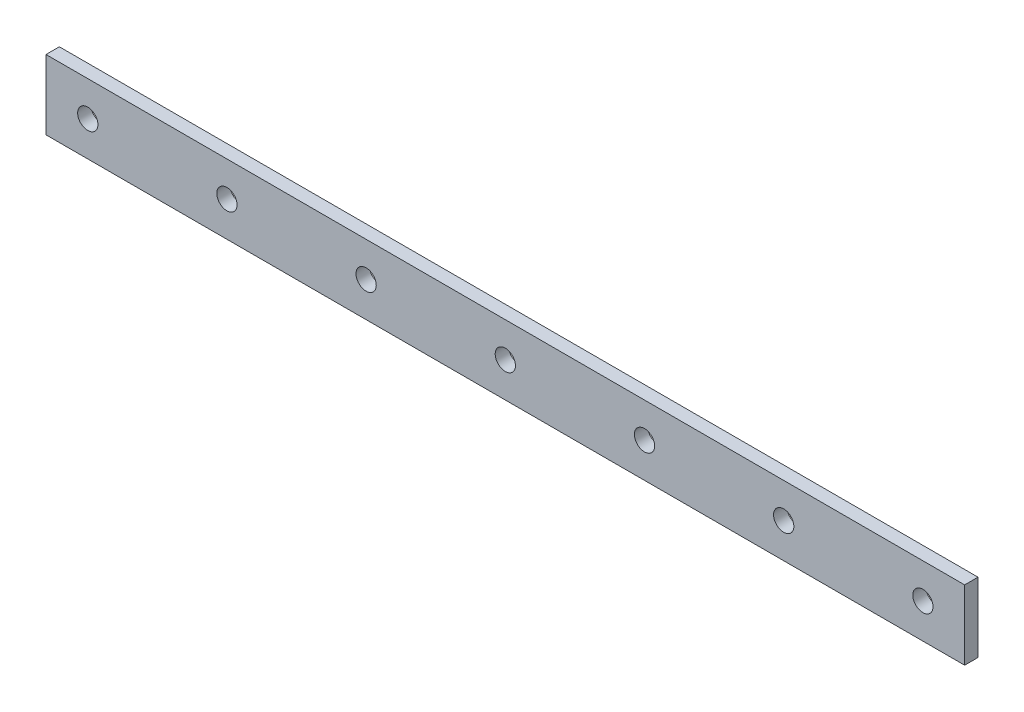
SolidWorks part; units mm, degrees
ref_plane "Front Plane" through (0, 0, 0) normal (0, 0, 1) x (1, 0, 0)
ref_plane "Top Plane" through (0, 0, 0) normal (0, 1, 0) x (1, 0, 0)
ref_plane "Right Plane" through (0, 0, 0) normal (1, 0, 0) x (0, 0, -1)
sketch "Sketch1" plane through (0, 0, 0) normal (0, 0, 1) x (1, 0, 0)
  line L0 (0, 0) -> (0, 41.5923) construction
  line L2 (52.3875, -3.9687) -> (-52.3875, -3.9688)
  line L3 (52.3875, -3.9687) -> (52.3875, 3.9688)
  line L4 (52.3875, 3.9688) -> (-52.3875, 3.9687)
  line L5 (-52.3875, -3.9688) -> (-52.3875, 3.9687)
  line L6 (52.3875, -3.9687) -> (-52.3875, 3.9687) construction
  line L7 (52.3875, 3.9688) -> (-52.3875, -3.9688) construction
  dimension "D1" = 7.9375
  dimension "D2" = 104.775
extrude "Boss-Extrude1" add sketch "Sketch1" along normal blind 1.524
sketch "Sketch2" plane through (0, 0, 1.524) normal (0, 0, 1) x (1, 0, 0)
  circle A0 centre (0, 0) radius 1.1557
  dimension "D1" = 2.3114
extrude "Cut-Extrude1" cut sketch "Sketch2" against normal through all
pattern_linear "LPattern1" count 4 spacing 15.875 along (1, 0, 0) count 4 spacing 15.875 along (-1, 0, 0) of "Cut-Extrude1"
